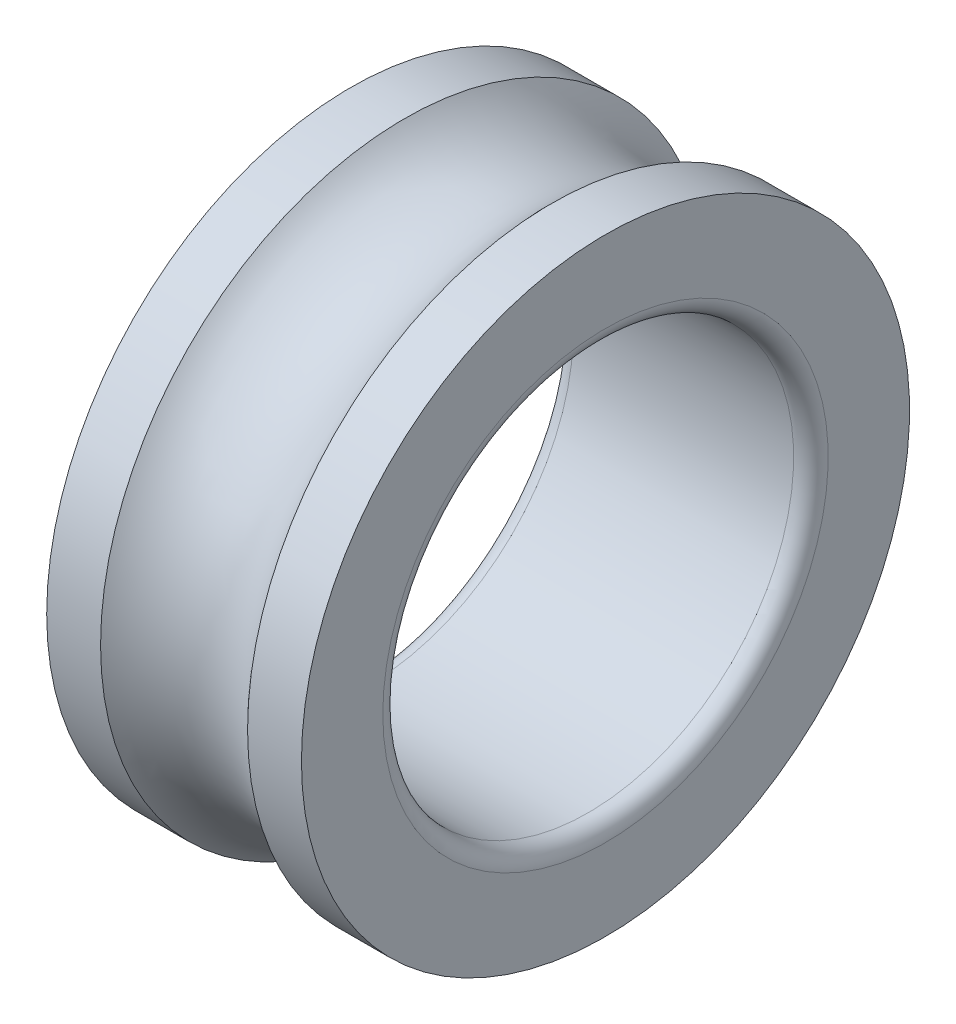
SolidWorks part; units mm, degrees
ref_plane "Front Plane" through (0, 0, 0) normal (0, 0, 1) x (1, 0, 0)
ref_plane "Top Plane" through (0, 0, 0) normal (0, 1, 0) x (1, 0, 0)
ref_plane "Right Plane" through (0, 0, 0) normal (1, 0, 0) x (0, 0, -1)
sketch "Sketch1" plane through (0, 0, 0) normal (0, 0, 1) x (1, 0, 0)
  line L0 (-27.7147, 0) -> (53.5761, 0) construction
  line L1 (0, 31) -> (0, -26.7038) construction
  line L2 (0, 31) -> (0, 33) construction
  line L3 (-15.5, 37) -> (-8.9443, 37)
  line L4 (-15.5, 37) -> (-15.5, 27.1)
  line L5 (-13.4, 25) -> (13.4, 25)
  line L6 (15.5, 37) -> (15.5, 27.1)
  line L7 (-15.5, 37) -> (15.5, 25) construction
  line L8 (-15.5, 25) -> (15.5, 37) construction
  line L9 (8.9443, 37) -> (15.5, 37)
  arc A0 (-8.9443, 37) -> (8.9443, 37) centre (0, 45) ccw
  arc A1 (13.4, 25) -> (15.5, 27.1) centre (13.4, 27.1) ccw
  arc A2 (-15.5, 27.1) -> (-13.4, 25) centre (-13.4, 27.1) ccw
  dimension "D5" = 12
  dimension "D6" = 2.1
  dimension "D1" = 31
  dimension "D2" = 25
  dimension "D3" = 37
  dimension "D4" = 8
revolve "Revolve1" add sketch "Sketch1" angle 360 about L0
